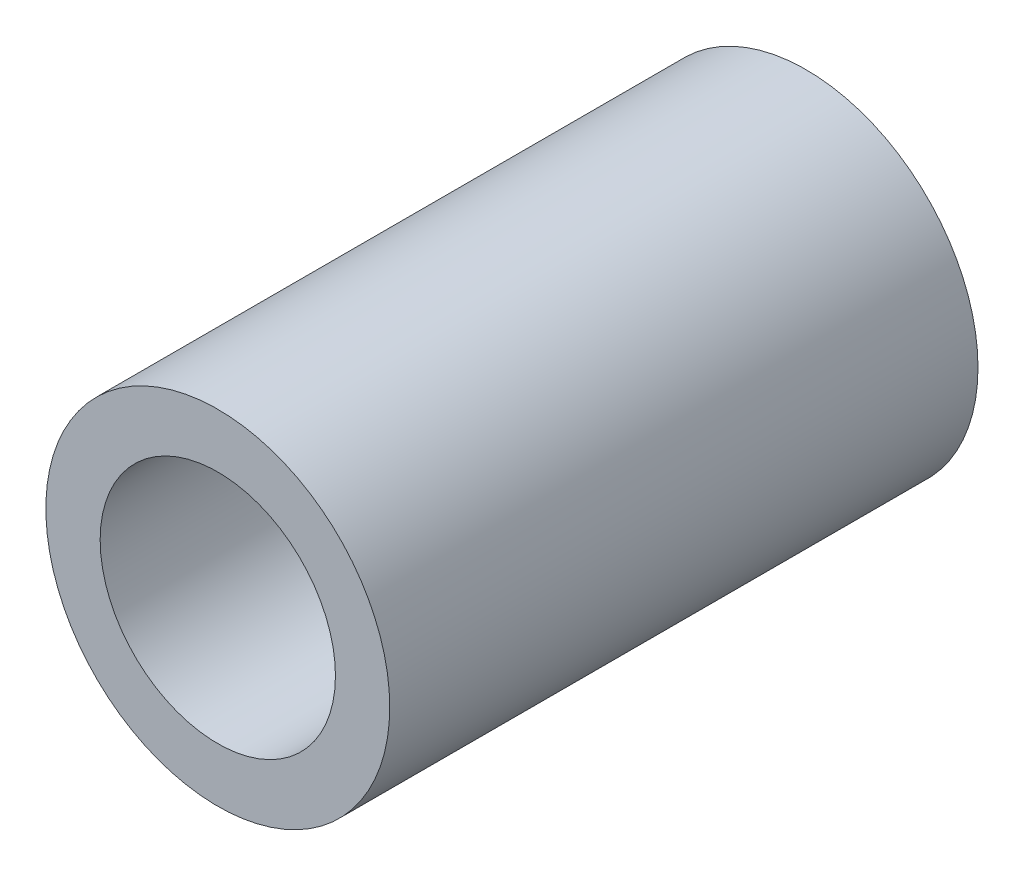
SolidWorks part; units mm, degrees
ref_plane "Front Plane" through (0, 0, 0) normal (0, 0, 1) x (1, 0, 0)
ref_plane "Top Plane" through (0, 0, 0) normal (0, 1, 0) x (1, 0, 0)
ref_plane "Right Plane" through (0, 0, 0) normal (1, 0, 0) x (0, 0, -1)
sketch "Sketch1" plane through (0, 0, 0) normal (0, 0, 1) x (1, 0, 0)
  circle A0 centre (0, 0) radius 13
  circle A1 centre (0, 0) radius 19
extrude "Boss-Extrude1" add sketch "Sketch1" along normal blind 65
hole_wizard "#10-24 Tapped Hole1" positions "3DSketch2" profile "Sketch2" tap size "#10-24" standard "Ansi Inch"
sketch3d "3DSketch2"
  point P0 (0, -19, 32.5)
sketch "Sketch2" plane through (0, -19, 32.5) normal (1, 0, 0) x (0, 0, -1)
  line L0 (0, 0) -> (0, 6.1408)
  line L1 (0, 6.1408) -> (1.8986, 5)
  line L2 (1.8986, 5) -> (1.8986, 0)
  line L5 (1.8986, 0) -> (0, 0)
  line L10 (0, 6.1408) -> (-1.8987, 5) construction
  line L11 (0, -6.35) -> (0, 107.95) construction
  dimension "Tap Drill Dia." = 3.7973
  dimension "Tap Drill Depth" = 5
  dimension "Drill Angle" = 118
